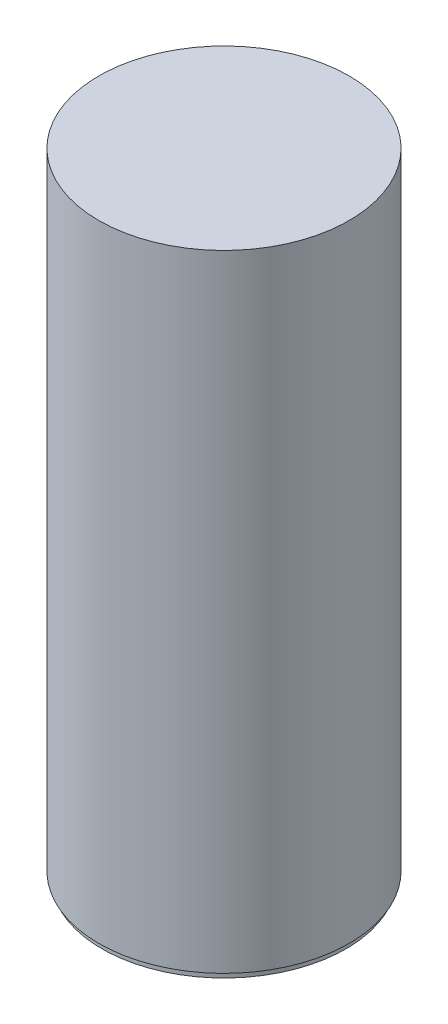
SolidWorks part; units mm, degrees
ref_plane "Alzado" through (0, 0, 0) normal (0, 0, 1) x (1, 0, 0)
ref_plane "Planta" through (0, 0, 0) normal (0, 1, 0) x (1, 0, 0)
ref_plane "Vista lateral" through (0, 0, 0) normal (1, 0, 0) x (0, 0, -1)
sketch "Croquis1" plane through (0, 0, 0) normal (0, 1, 0) x (1, 0, 0)
  circle A0 centre (0, 0) radius 20
extrude "Saliente-Extruir1" add sketch "Croquis1" along normal blind 100
sketch "Croquis2" plane through (0, 0, 0) normal (0, -1, 0) x (1, 0, 0)
  circle A0 centre (0, 0) radius 19.497
extrude "Saliente-Extruir3" add sketch "Croquis2" along normal blind 1
sketch "Croquis3" plane through (0, -1, 0) normal (0, -1, 0) x (1, 0, 0)
  circle A0 centre (0, 0) radius 17.56
extrude "Cortar-Extruir1" cut sketch "Croquis3" against normal blind 7 draft 22
